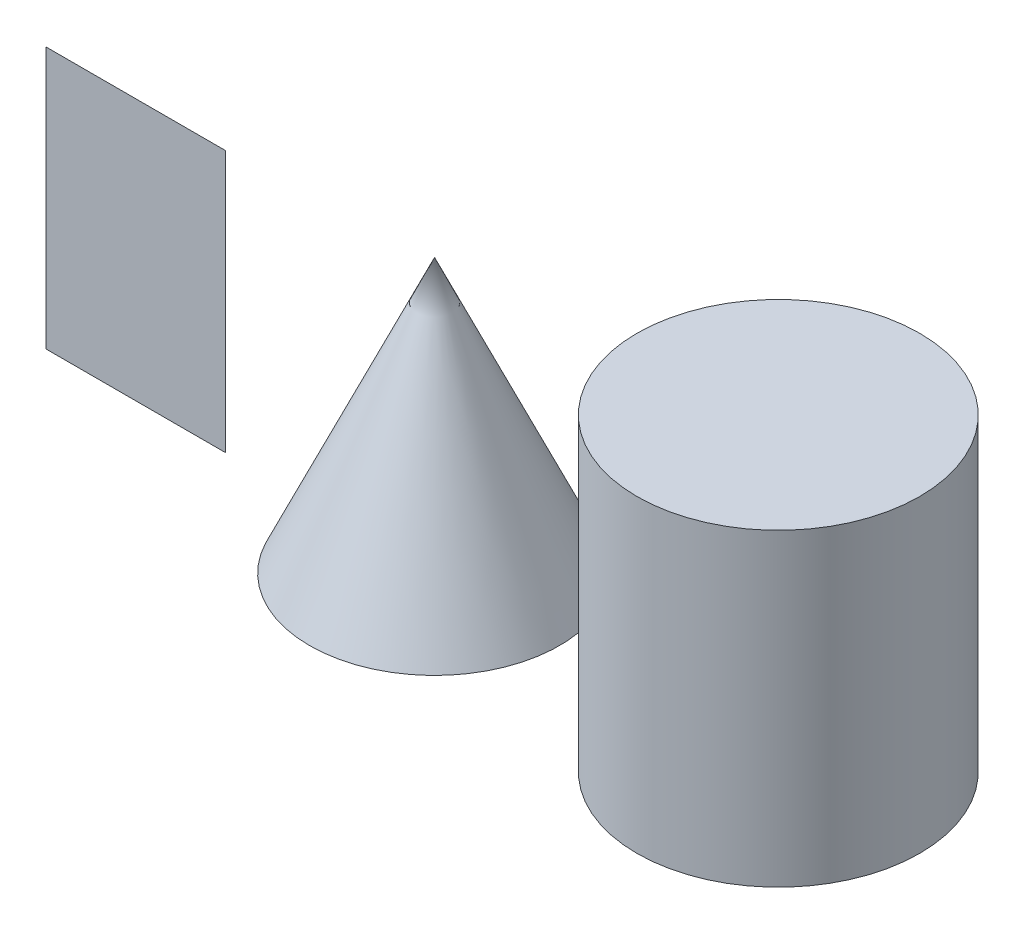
SolidWorks part; units mm, degrees
ref_plane "Front XY" through (0, 0, 0) normal (0, 0, 1) x (1, 0, 0)
ref_plane "Top XZ" through (0, 0, 0) normal (0, 1, 0) x (1, 0, 0)
ref_plane "Right YZ" through (0, 0, 0) normal (1, 0, 0) x (0, 0, -1)
sketch "Sketch1" plane through (0, 0, 0) normal (0, 0, 1) x (1, 0, 0)
  line L1 (0, 0) -> (28.102, 0)
  line L2 (0, 0) -> (0, 40.9607)
  line L3 (0, 40.9607) -> (28.102, 40.9607)
  line L4 (28.102, 0) -> (28.102, 40.9607)
surface "Surface-Plane1" sketch "Sketch1"
sketch "Sketch2" plane through (0, 0, 0) normal (0, 0, 1) x (1, 0, 0)
  line L0 (60.8376, 42.839) -> (60.8376, 0)
  line L1 (60.8376, 0) -> (41.2499, 0)
  line L2 (41.2499, 0) -> (60.8376, 42.839)
revolve "Revolve1" add sketch "Sketch2" angle 360 about L0
sketch "Sketch3" plane through (0, 0, 0) normal (0, 0, 1) x (1, 0, 0)
  line L1 (114.6595, 48.3958) -> (92.5215, 48.3958)
  line L2 (114.6595, 48.3958) -> (114.6595, 0)
  line L3 (114.6595, 0) -> (92.5215, 0)
  line L4 (92.5215, 48.3958) -> (92.5215, 0)
revolve "Revolve2" add sketch "Sketch3" angle 360 about L2
sketch3d "3DSketch1"
  spline S0 degree 1 poles (28.102, -1999.9921, 0) (28.102, 2040.9451, 0) knots -48.827105 -48.827105 49.826917 49.826917 only from (28.102, 0, 0) to (28.102, 40.9607, 0) construction
  spline S1 degree 1 poles (28.102, 0, 0) (28.102, 40.9607, 0) knots 0 0 1 1
sketch3d "3DSketch2"
  spline S0 degree 1 poles (22.4816, -1999.9921, 0) (22.4816, 2040.9451, 0) knots -48.827105 -48.827105 49.826917 49.826917 only from (22.4816, 0, 0) to (22.4816, 40.9607, 0) construction
  spline S1 degree 1 poles (22.4816, 0, 0) (22.4816, 40.9607, 0) knots 0 0 1 1
sketch3d "3DSketch3"
  spline S0 degree 1 poles (16.8612, -1999.9921, 0) (16.8612, 2040.9451, 0) knots -48.827105 -48.827105 49.826917 49.826917 only from (16.8612, 0, 0) to (16.8612, 40.9607, 0) construction
  spline S1 degree 1 poles (16.8612, 0, 0) (16.8612, 40.9607, 0) knots 0 0 1 1
sketch3d "3DSketch4"
  spline S0 degree 1 poles (11.2408, -1999.9921, 0) (11.2408, 2040.9451, 0) knots -48.827105 -48.827105 49.826917 49.826917 only from (11.2408, 0, 0) to (11.2408, 40.9607, 0) construction
  spline S1 degree 1 poles (11.2408, 0, 0) (11.2408, 40.9607, 0) knots 0 0 1 1
sketch3d "3DSketch5"
  spline S0 degree 1 poles (5.6204, -1999.9921, 0) (5.6204, 2040.9451, 0) knots -48.827105 -48.827105 49.826917 49.826917 only from (5.6204, 0, 0) to (5.6204, 40.9607, 0) construction
  spline S1 degree 1 poles (5.6204, 0, 0) (5.6204, 40.9607, 0) knots 0 0 1 1
sketch3d "3DSketch6"
  spline S0 degree 1 poles (0, -1999.9921, 0) (0, 2040.9451, 0) knots -48.827105 -48.827105 49.826917 49.826917 only from (0, 0, 0) to (0, 40.9607, 0) construction
  spline S1 degree 1 poles (0, 0, 0) (0, 40.9607, 0) knots 0 0 1 1
sketch3d "3DSketch7"
  spline S0 degree 1 poles (2028.0904, 0, 0) (-1999.9817, 0, 0) knots -71.169005 -71.169005 72.168768 72.168768 only from (28.102, 0, 0) to (0, 0, 0) construction
  spline S1 degree 1 poles (28.102, 0, 0) (0, 0, 0) knots 0 0 1 1
sketch3d "3DSketch8"
  spline S0 degree 1 poles (2028.0904, 6.8268, 0) (-1999.9817, 6.8268, 0) knots -71.169005 -71.169005 72.168768 72.168768 only from (28.102, 6.8268, 0) to (0, 6.8268, 0) construction
  spline S1 degree 1 poles (28.102, 6.8268, 0) (0, 6.8268, 0) knots 0 0 1 1
sketch3d "3DSketch9"
  spline S0 degree 1 poles (2028.0904, 13.6536, 0) (-1999.9817, 13.6536, 0) knots -71.169005 -71.169005 72.168768 72.168768 only from (28.102, 13.6536, 0) to (0, 13.6536, 0) construction
  spline S1 degree 1 poles (28.102, 13.6536, 0) (0, 13.6536, 0) knots 0 0 1 1
sketch3d "3DSketch10"
  spline S0 degree 1 poles (2028.0904, 20.4803, 0) (-1999.9817, 20.4803, 0) knots -71.169005 -71.169005 72.168768 72.168768 only from (28.102, 20.4803, 0) to (0, 20.4803, 0) construction
  spline S1 degree 1 poles (28.102, 20.4803, 0) (0, 20.4803, 0) knots 0 0 1 1
sketch3d "3DSketch11"
  spline S0 degree 1 poles (2028.0904, 27.3071, 0) (-1999.9817, 27.3071, 0) knots -71.169005 -71.169005 72.168768 72.168768 only from (28.102, 27.3071, 0) to (0, 27.3071, 0) construction
  spline S1 degree 1 poles (28.102, 27.3071, 0) (0, 27.3071, 0) knots 0 0 1 1
sketch3d "3DSketch12"
  spline S0 degree 1 poles (2028.0904, 34.1339, 0) (-1999.9817, 34.1339, 0) knots -71.169005 -71.169005 72.168768 72.168768 only from (28.102, 34.1339, 0) to (0, 34.1339, 0) construction
  spline S1 degree 1 poles (28.102, 34.1339, 0) (0, 34.1339, 0) knots 0 0 1 1
sketch3d "3DSketch13"
  spline S0 degree 1 poles (2028.0904, 40.9607, 0) (-1999.9817, 40.9607, 0) knots -71.169005 -71.169005 72.168768 72.168768 only from (28.102, 40.9607, 0) to (0, 40.9607, 0) construction
  spline S1 degree 1 poles (28.102, 40.9607, 0) (0, 40.9607, 0) knots 0 0 1 1
sketch3d "3DSketch14"
  spline S0 degree 1 poles (60.8376, 1861.7168, 831.6653) (60.8376, -1818.8638, -851.2466) knots -42.458487 -42.458487 43.45816 43.45816 only from (60.8376, 42.839, 0) to (60.8376, 0, -19.5877) construction
  spline S1 degree 1 poles (60.8376, 42.839, 0) (60.8376, 0, -19.5877) knots 0 0 1 1
sketch3d "3DSketch15"
  spline S0 degree 1 poles (-659.4057, 1861.7168, 415.8326) (798.0388, -1818.8638, -425.6233) knots -42.458487 -42.458487 43.45816 43.45816 only from (60.8376, 42.839, 0) to (77.8011, 0, -9.7939) construction
  spline S1 degree 1 poles (60.8376, 42.839, 0) (77.8011, 0, -9.7939) knots 0 0 1 1
sketch3d "3DSketch16"
  spline S0 degree 1 poles (-659.4057, 1861.7168, -415.8326) (798.0388, -1818.8638, 425.6233) knots -42.458487 -42.458487 43.45816 43.45816 only from (60.8376, 42.839, 0) to (77.8011, 0, 9.7939) construction
  spline S1 degree 1 poles (60.8376, 42.839, 0) (77.8011, 0, 9.7939) knots 0 0 1 1
sketch3d "3DSketch17"
  spline S0 degree 1 poles (60.8376, 1861.7168, -831.6653) (60.8376, -1818.8638, 851.2466) knots -42.458487 -42.458487 43.45816 43.45816 only from (60.8376, 42.839, 0) to (60.8376, 0, 19.5877) construction
  spline S1 degree 1 poles (60.8376, 42.839, 0) (60.8376, 0, 19.5877) knots 0 0 1 1
sketch3d "3DSketch18"
  spline S0 degree 1 poles (781.0809, 1861.7168, -415.8326) (-676.3636, -1818.8638, 425.6233) knots -42.458487 -42.458487 43.45816 43.45816 only from (60.8376, 42.839, 0) to (43.8741, 0, 9.7939) construction
  spline S1 degree 1 poles (60.8376, 42.839, 0) (43.8741, 0, 9.7939) knots 0 0 1 1
sketch3d "3DSketch19"
  spline S0 degree 1 poles (781.0809, 1861.7168, 415.8326) (-676.3636, -1818.8638, -425.6233) knots -42.458487 -42.458487 43.45816 43.45816 only from (60.8376, 42.839, 0) to (43.8741, 0, -9.7939) construction
  spline S1 degree 1 poles (60.8376, 42.839, 0) (43.8741, 0, -9.7939) knots 0 0 1 1
sketch3d "3DSketch20"
  point P0 (60.8376, 42.839, 0)
sketch3d "3DSketch21"
  spline S0 degree 3 poles (60.8376, 35.6991, -3.2646) (67.3669, 35.6991, -3.2646) (67.3669, 35.6991, 3.2646) (60.8376, 35.6991, 3.2646) (54.3084, 35.6991, 3.2646) (54.3084, 35.6991, -3.2646) (60.8376, 35.6991, -3.2646) (67.3669, 35.6991, -3.2646) (67.3669, 35.6991, 3.2646) knots -0.5 0 0 0 0.5 0.5 0.5 1 1 1 1.5 1.5 1.5 weights 1 0.333333 0.333333 1 0.333333 0.333333 1 0.333333 0.333333 only from (60.8376, 35.6991, -3.2646) to (60.8376, 35.6991, -3.2646) construction
  spline S1 degree 3 poles (60.8376, 35.6991, -3.2646) (67.3669, 35.6991, -3.2646) (67.3669, 35.6991, 3.2646) (60.8376, 35.6991, 3.2646) (54.3084, 35.6991, 3.2646) (54.3084, 35.6991, -3.2646) (60.8376, 35.6991, -3.2646) (67.3669, 35.6991, -3.2646) (67.3669, 35.6991, 3.2646) knots -0.5 0 0 0 0.5 0.5 0.5 1 1 1 1.5 1.5 1.5 weights 1 0.333333 0.333333 1 0.333333 0.333333 1 0.333333 0.333333 only from (60.8376, 35.6991, -3.2646) to (60.8376, 35.6991, -3.2646)
sketch3d "3DSketch22"
  spline S0 degree 3 poles (60.8376, 28.5593, -6.5292) (73.8961, 28.5593, -6.5292) (73.8961, 28.5593, 6.5292) (60.8376, 28.5593, 6.5292) (47.7791, 28.5593, 6.5292) (47.7791, 28.5593, -6.5292) (60.8376, 28.5593, -6.5292) (73.8961, 28.5593, -6.5292) (73.8961, 28.5593, 6.5292) knots -0.5 0 0 0 0.5 0.5 0.5 1 1 1 1.5 1.5 1.5 weights 1 0.333333 0.333333 1 0.333333 0.333333 1 0.333333 0.333333 only from (60.8376, 28.5593, -6.5292) to (60.8376, 28.5593, -6.5292) construction
  spline S1 degree 3 poles (60.8376, 28.5593, -6.5292) (73.8961, 28.5593, -6.5292) (73.8961, 28.5593, 6.5292) (60.8376, 28.5593, 6.5292) (47.7791, 28.5593, 6.5292) (47.7791, 28.5593, -6.5292) (60.8376, 28.5593, -6.5292) (73.8961, 28.5593, -6.5292) (73.8961, 28.5593, 6.5292) knots -0.5 0 0 0 0.5 0.5 0.5 1 1 1 1.5 1.5 1.5 weights 1 0.333333 0.333333 1 0.333333 0.333333 1 0.333333 0.333333 only from (60.8376, 28.5593, -6.5292) to (60.8376, 28.5593, -6.5292)
sketch3d "3DSketch23"
  spline S0 degree 3 poles (60.8376, 21.4195, -9.7939) (80.4253, 21.4195, -9.7939) (80.4253, 21.4195, 9.7939) (60.8376, 21.4195, 9.7939) (41.2499, 21.4195, 9.7939) (41.2499, 21.4195, -9.7939) (60.8376, 21.4195, -9.7939) (80.4253, 21.4195, -9.7939) (80.4253, 21.4195, 9.7939) knots -0.5 0 0 0 0.5 0.5 0.5 1 1 1 1.5 1.5 1.5 weights 1 0.333333 0.333333 1 0.333333 0.333333 1 0.333333 0.333333 only from (60.8376, 21.4195, -9.7939) to (60.8376, 21.4195, -9.7939) construction
  spline S1 degree 3 poles (60.8376, 21.4195, -9.7939) (80.4253, 21.4195, -9.7939) (80.4253, 21.4195, 9.7939) (60.8376, 21.4195, 9.7939) (41.2499, 21.4195, 9.7939) (41.2499, 21.4195, -9.7939) (60.8376, 21.4195, -9.7939) (80.4253, 21.4195, -9.7939) (80.4253, 21.4195, 9.7939) knots -0.5 0 0 0 0.5 0.5 0.5 1 1 1 1.5 1.5 1.5 weights 1 0.333333 0.333333 1 0.333333 0.333333 1 0.333333 0.333333 only from (60.8376, 21.4195, -9.7939) to (60.8376, 21.4195, -9.7939)
sketch3d "3DSketch24"
  spline S0 degree 3 poles (60.8376, 14.2797, -13.0585) (86.9546, 14.2797, -13.0585) (86.9546, 14.2797, 13.0585) (60.8376, 14.2797, 13.0585) (34.7206, 14.2797, 13.0585) (34.7206, 14.2797, -13.0585) (60.8376, 14.2797, -13.0585) (86.9546, 14.2797, -13.0585) (86.9546, 14.2797, 13.0585) knots -0.5 0 0 0 0.5 0.5 0.5 1 1 1 1.5 1.5 1.5 weights 1 0.333333 0.333333 1 0.333333 0.333333 1 0.333333 0.333333 only from (60.8376, 14.2797, -13.0585) to (60.8376, 14.2797, -13.0585) construction
  spline S1 degree 3 poles (60.8376, 14.2797, -13.0585) (86.9546, 14.2797, -13.0585) (86.9546, 14.2797, 13.0585) (60.8376, 14.2797, 13.0585) (34.7206, 14.2797, 13.0585) (34.7206, 14.2797, -13.0585) (60.8376, 14.2797, -13.0585) (86.9546, 14.2797, -13.0585) (86.9546, 14.2797, 13.0585) knots -0.5 0 0 0 0.5 0.5 0.5 1 1 1 1.5 1.5 1.5 weights 1 0.333333 0.333333 1 0.333333 0.333333 1 0.333333 0.333333 only from (60.8376, 14.2797, -13.0585) to (60.8376, 14.2797, -13.0585)
sketch3d "3DSketch25"
  spline S0 degree 3 poles (60.8376, 7.1398, -16.3231) (93.4838, 7.1398, -16.3231) (93.4838, 7.1398, 16.3231) (60.8376, 7.1398, 16.3231) (28.1914, 7.1398, 16.3231) (28.1914, 7.1398, -16.3231) (60.8376, 7.1398, -16.3231) (93.4838, 7.1398, -16.3231) (93.4838, 7.1398, 16.3231) knots -0.5 0 0 0 0.5 0.5 0.5 1 1 1 1.5 1.5 1.5 weights 1 0.333333 0.333333 1 0.333333 0.333333 1 0.333333 0.333333 only from (60.8376, 7.1398, -16.3231) to (60.8376, 7.1398, -16.3231) construction
  spline S1 degree 3 poles (60.8376, 7.1398, -16.3231) (93.4838, 7.1398, -16.3231) (93.4838, 7.1398, 16.3231) (60.8376, 7.1398, 16.3231) (28.1914, 7.1398, 16.3231) (28.1914, 7.1398, -16.3231) (60.8376, 7.1398, -16.3231) (93.4838, 7.1398, -16.3231) (93.4838, 7.1398, 16.3231) knots -0.5 0 0 0 0.5 0.5 0.5 1 1 1 1.5 1.5 1.5 weights 1 0.333333 0.333333 1 0.333333 0.333333 1 0.333333 0.333333 only from (60.8376, 7.1398, -16.3231) to (60.8376, 7.1398, -16.3231)
sketch3d "3DSketch26"
  spline S0 degree 3 poles (60.8376, 0, -19.5877) (100.0131, 0, -19.5877) (100.0131, 0, 19.5877) (60.8376, 0, 19.5877) (21.6622, 0, 19.5877) (21.6622, 0, -19.5877) (60.8376, 0, -19.5877) (100.0131, 0, -19.5877) (100.0131, 0, 19.5877) knots -0.5 0 0 0 0.5 0.5 0.5 1 1 1 1.5 1.5 1.5 weights 1 0.333333 0.333333 1 0.333333 0.333333 1 0.333333 0.333333 only from (60.8376, 0, -19.5877) to (60.8376, 0, -19.5877) construction
  spline S1 degree 3 poles (60.8376, 0, -19.5877) (100.0131, 0, -19.5877) (100.0131, 0, 19.5877) (60.8376, 0, 19.5877) (21.6622, 0, 19.5877) (21.6622, 0, -19.5877) (60.8376, 0, -19.5877) (100.0131, 0, -19.5877) (100.0131, 0, 19.5877) knots -0.5 0 0 0 0.5 0.5 0.5 1 1 1 1.5 1.5 1.5 weights 1 0.333333 0.333333 1 0.333333 0.333333 1 0.333333 0.333333 only from (60.8376, 0, -19.5877) to (60.8376, 0, -19.5877)
sketch3d "3DSketch27"
  spline S0 degree 1 poles (114.6595, -1999.9942, 22.138) (114.6595, 2048.3831, 22.138) knots -41.325807 -41.325807 42.325665 42.325665 only from (114.6595, 0, 22.138) to (114.6595, 48.3958, 22.138) construction
  spline S1 degree 1 poles (114.6595, 0, 22.138) (114.6595, 48.3958, 22.138) knots 0 0 1 1
sketch3d "3DSketch28"
  spline S0 degree 1 poles (133.8316, -1999.9942, 11.069) (133.8316, 2048.3831, 11.069) knots -41.325807 -41.325807 42.325665 42.325665 only from (133.8316, 0, 11.069) to (133.8316, 48.3958, 11.069) construction
  spline S1 degree 1 poles (133.8316, 0, 11.069) (133.8316, 48.3958, 11.069) knots 0 0 1 1
sketch3d "3DSketch29"
  spline S0 degree 1 poles (133.8316, -1999.9942, -11.069) (133.8316, 2048.3831, -11.069) knots -41.325807 -41.325807 42.325665 42.325665 only from (133.8316, 0, -11.069) to (133.8316, 48.3958, -11.069) construction
  spline S1 degree 1 poles (133.8316, 0, -11.069) (133.8316, 48.3958, -11.069) knots 0 0 1 1
sketch3d "3DSketch30"
  spline S0 degree 1 poles (114.6595, -1999.9942, -22.138) (114.6595, 2048.3831, -22.138) knots -41.325807 -41.325807 42.325665 42.325665 only from (114.6595, 0, -22.138) to (114.6595, 48.3958, -22.138) construction
  spline S1 degree 1 poles (114.6595, 0, -22.138) (114.6595, 48.3958, -22.138) knots 0 0 1 1
sketch3d "3DSketch31"
  spline S0 degree 1 poles (95.4874, -1999.9942, -11.069) (95.4874, 2048.3831, -11.069) knots -41.325807 -41.325807 42.325665 42.325665 only from (95.4874, 0, -11.069) to (95.4874, 48.3958, -11.069) construction
  spline S1 degree 1 poles (95.4874, 0, -11.069) (95.4874, 48.3958, -11.069) knots 0 0 1 1
sketch3d "3DSketch32"
  spline S0 degree 1 poles (95.4874, -1999.9942, 11.069) (95.4874, 2048.3831, 11.069) knots -41.325807 -41.325807 42.325665 42.325665 only from (95.4874, 0, 11.069) to (95.4874, 48.3958, 11.069) construction
  spline S1 degree 1 poles (95.4874, 0, 11.069) (95.4874, 48.3958, 11.069) knots 0 0 1 1
sketch3d "3DSketch33"
  spline S0 degree 3 poles (114.6595, 0, 22.138) (158.9355, 0, 22.138) (158.9355, 0, -22.138) (114.6595, 0, -22.138) (70.3834, 0, -22.138) (70.3834, 0, 22.138) (114.6595, 0, 22.138) (158.9355, 0, 22.138) (158.9355, 0, -22.138) knots -0.5 0 0 0 0.5 0.5 0.5 1 1 1 1.5 1.5 1.5 weights 1 0.333333 0.333333 1 0.333333 0.333333 1 0.333333 0.333333 only from (114.6595, 0, 22.138) to (114.6595, 0, 22.138) construction
  spline S1 degree 3 poles (114.6595, 0, 22.138) (158.9355, 0, 22.138) (158.9355, 0, -22.138) (114.6595, 0, -22.138) (70.3834, 0, -22.138) (70.3834, 0, 22.138) (114.6595, 0, 22.138) (158.9355, 0, 22.138) (158.9355, 0, -22.138) knots -0.5 0 0 0 0.5 0.5 0.5 1 1 1 1.5 1.5 1.5 weights 1 0.333333 0.333333 1 0.333333 0.333333 1 0.333333 0.333333 only from (114.6595, 0, 22.138) to (114.6595, 0, 22.138)
sketch3d "3DSketch34"
  spline S0 degree 3 poles (114.6595, 8.066, 22.138) (158.9355, 8.066, 22.138) (158.9355, 8.066, -22.138) (114.6595, 8.066, -22.138) (70.3834, 8.066, -22.138) (70.3834, 8.066, 22.138) (114.6595, 8.066, 22.138) (158.9355, 8.066, 22.138) (158.9355, 8.066, -22.138) knots -0.5 0 0 0 0.5 0.5 0.5 1 1 1 1.5 1.5 1.5 weights 1 0.333333 0.333333 1 0.333333 0.333333 1 0.333333 0.333333 only from (114.6595, 8.066, 22.138) to (114.6595, 8.066, 22.138) construction
  spline S1 degree 3 poles (114.6595, 8.066, 22.138) (158.9355, 8.066, 22.138) (158.9355, 8.066, -22.138) (114.6595, 8.066, -22.138) (70.3834, 8.066, -22.138) (70.3834, 8.066, 22.138) (114.6595, 8.066, 22.138) (158.9355, 8.066, 22.138) (158.9355, 8.066, -22.138) knots -0.5 0 0 0 0.5 0.5 0.5 1 1 1 1.5 1.5 1.5 weights 1 0.333333 0.333333 1 0.333333 0.333333 1 0.333333 0.333333 only from (114.6595, 8.066, 22.138) to (114.6595, 8.066, 22.138)
sketch3d "3DSketch35"
  spline S0 degree 3 poles (114.6595, 16.1319, 22.138) (158.9355, 16.1319, 22.138) (158.9355, 16.1319, -22.138) (114.6595, 16.1319, -22.138) (70.3834, 16.1319, -22.138) (70.3834, 16.1319, 22.138) (114.6595, 16.1319, 22.138) (158.9355, 16.1319, 22.138) (158.9355, 16.1319, -22.138) knots -0.5 0 0 0 0.5 0.5 0.5 1 1 1 1.5 1.5 1.5 weights 1 0.333333 0.333333 1 0.333333 0.333333 1 0.333333 0.333333 only from (114.6595, 16.1319, 22.138) to (114.6595, 16.1319, 22.138) construction
  spline S1 degree 3 poles (114.6595, 16.1319, 22.138) (158.9355, 16.1319, 22.138) (158.9355, 16.1319, -22.138) (114.6595, 16.1319, -22.138) (70.3834, 16.1319, -22.138) (70.3834, 16.1319, 22.138) (114.6595, 16.1319, 22.138) (158.9355, 16.1319, 22.138) (158.9355, 16.1319, -22.138) knots -0.5 0 0 0 0.5 0.5 0.5 1 1 1 1.5 1.5 1.5 weights 1 0.333333 0.333333 1 0.333333 0.333333 1 0.333333 0.333333 only from (114.6595, 16.1319, 22.138) to (114.6595, 16.1319, 22.138)
sketch3d "3DSketch36"
  spline S0 degree 3 poles (114.6595, 24.1979, 22.138) (158.9355, 24.1979, 22.138) (158.9355, 24.1979, -22.138) (114.6595, 24.1979, -22.138) (70.3834, 24.1979, -22.138) (70.3834, 24.1979, 22.138) (114.6595, 24.1979, 22.138) (158.9355, 24.1979, 22.138) (158.9355, 24.1979, -22.138) knots -0.5 0 0 0 0.5 0.5 0.5 1 1 1 1.5 1.5 1.5 weights 1 0.333333 0.333333 1 0.333333 0.333333 1 0.333333 0.333333 only from (114.6595, 24.1979, 22.138) to (114.6595, 24.1979, 22.138) construction
  spline S1 degree 3 poles (114.6595, 24.1979, 22.138) (158.9355, 24.1979, 22.138) (158.9355, 24.1979, -22.138) (114.6595, 24.1979, -22.138) (70.3834, 24.1979, -22.138) (70.3834, 24.1979, 22.138) (114.6595, 24.1979, 22.138) (158.9355, 24.1979, 22.138) (158.9355, 24.1979, -22.138) knots -0.5 0 0 0 0.5 0.5 0.5 1 1 1 1.5 1.5 1.5 weights 1 0.333333 0.333333 1 0.333333 0.333333 1 0.333333 0.333333 only from (114.6595, 24.1979, 22.138) to (114.6595, 24.1979, 22.138)
sketch3d "3DSketch37"
  spline S0 degree 3 poles (114.6595, 32.2638, 22.138) (158.9355, 32.2638, 22.138) (158.9355, 32.2638, -22.138) (114.6595, 32.2638, -22.138) (70.3834, 32.2638, -22.138) (70.3834, 32.2638, 22.138) (114.6595, 32.2638, 22.138) (158.9355, 32.2638, 22.138) (158.9355, 32.2638, -22.138) knots -0.5 0 0 0 0.5 0.5 0.5 1 1 1 1.5 1.5 1.5 weights 1 0.333333 0.333333 1 0.333333 0.333333 1 0.333333 0.333333 only from (114.6595, 32.2638, 22.138) to (114.6595, 32.2638, 22.138) construction
  spline S1 degree 3 poles (114.6595, 32.2638, 22.138) (158.9355, 32.2638, 22.138) (158.9355, 32.2638, -22.138) (114.6595, 32.2638, -22.138) (70.3834, 32.2638, -22.138) (70.3834, 32.2638, 22.138) (114.6595, 32.2638, 22.138) (158.9355, 32.2638, 22.138) (158.9355, 32.2638, -22.138) knots -0.5 0 0 0 0.5 0.5 0.5 1 1 1 1.5 1.5 1.5 weights 1 0.333333 0.333333 1 0.333333 0.333333 1 0.333333 0.333333 only from (114.6595, 32.2638, 22.138) to (114.6595, 32.2638, 22.138)
sketch3d "3DSketch38"
  spline S0 degree 3 poles (114.6595, 40.3298, 22.138) (158.9355, 40.3298, 22.138) (158.9355, 40.3298, -22.138) (114.6595, 40.3298, -22.138) (70.3834, 40.3298, -22.138) (70.3834, 40.3298, 22.138) (114.6595, 40.3298, 22.138) (158.9355, 40.3298, 22.138) (158.9355, 40.3298, -22.138) knots -0.5 0 0 0 0.5 0.5 0.5 1 1 1 1.5 1.5 1.5 weights 1 0.333333 0.333333 1 0.333333 0.333333 1 0.333333 0.333333 only from (114.6595, 40.3298, 22.138) to (114.6595, 40.3298, 22.138) construction
  spline S1 degree 3 poles (114.6595, 40.3298, 22.138) (158.9355, 40.3298, 22.138) (158.9355, 40.3298, -22.138) (114.6595, 40.3298, -22.138) (70.3834, 40.3298, -22.138) (70.3834, 40.3298, 22.138) (114.6595, 40.3298, 22.138) (158.9355, 40.3298, 22.138) (158.9355, 40.3298, -22.138) knots -0.5 0 0 0 0.5 0.5 0.5 1 1 1 1.5 1.5 1.5 weights 1 0.333333 0.333333 1 0.333333 0.333333 1 0.333333 0.333333 only from (114.6595, 40.3298, 22.138) to (114.6595, 40.3298, 22.138)
sketch3d "3DSketch39"
  spline S0 degree 3 poles (114.6595, 48.3958, 22.138) (158.9355, 48.3958, 22.138) (158.9355, 48.3958, -22.138) (114.6595, 48.3958, -22.138) (70.3834, 48.3958, -22.138) (70.3834, 48.3958, 22.138) (114.6595, 48.3958, 22.138) (158.9355, 48.3958, 22.138) (158.9355, 48.3958, -22.138) knots -0.5 0 0 0 0.5 0.5 0.5 1 1 1 1.5 1.5 1.5 weights 1 0.333333 0.333333 1 0.333333 0.333333 1 0.333333 0.333333 only from (114.6595, 48.3958, 22.138) to (114.6595, 48.3958, 22.138) construction
  spline S1 degree 3 poles (114.6595, 48.3958, 22.138) (158.9355, 48.3958, 22.138) (158.9355, 48.3958, -22.138) (114.6595, 48.3958, -22.138) (70.3834, 48.3958, -22.138) (70.3834, 48.3958, 22.138) (114.6595, 48.3958, 22.138) (158.9355, 48.3958, 22.138) (158.9355, 48.3958, -22.138) knots -0.5 0 0 0 0.5 0.5 0.5 1 1 1 1.5 1.5 1.5 weights 1 0.333333 0.333333 1 0.333333 0.333333 1 0.333333 0.333333 only from (114.6595, 48.3958, 22.138) to (114.6595, 48.3958, 22.138)
